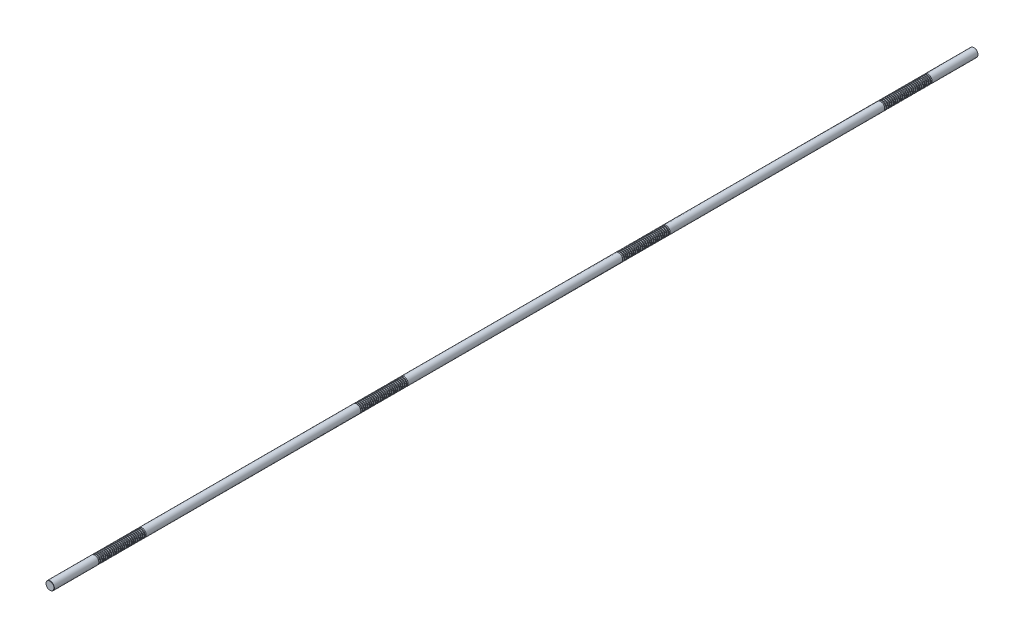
SolidWorks part; units mm, degrees
ref_plane "Front Plane" through (0, 0, 0) normal (0, 0, 1) x (1, 0, 0)
ref_plane "Top Plane" through (0, 0, 0) normal (0, 1, 0) x (1, 0, 0)
ref_plane "Right Plane" through (0, 0, 0) normal (1, 0, 0) x (0, 0, -1)
sketch "Sketch1" plane through (0, 0, 0) normal (0, 0, 1) x (1, 0, 0)
  circle A0 centre (0, 0) radius 9
  dimension "D1" = 18
extrude "Boss-Extrude1" add sketch "Sketch1" along normal mid plane 2000
chamfer "Chamfer1" distance 0.45 angle 45 2 edges at (9, 0, -1000) (9, 0, 1000)
sketch "Sketch2" plane through (0, 0, 0) normal (1, 0, 0) x (0, 0, -1)
  line L0 (900.3014, 9) -> (897.6986, 9)
  line L1 (999.55, 9) -> (-999.55, 9) construction
  line L2 (897.6986, 9) -> (898.3014, 6.75)
  line L3 (898.3014, 6.75) -> (899.6986, 6.75)
  line L4 (899.6986, 6.75) -> (900.3014, 9)
  line L5 (1000, -8.55) -> (1000, 8.55) construction
  point P4 (899, 9)
  point P7 (899, 6.75)
  point P8 (900, 7.875)
  point P9 (898, 7.875)
  dimension "D1" = 2
  dimension "D2" = 100
  dimension "D3" = 2.25
  dimension "D4" = 30
revolve "Cut-Revolve1" cut sketch "Sketch2" angle 360 about axis through (0, 0, 1000) along (0, 0, -1)
pattern_linear "LPattern1" count 26 spacing 4 along (0, 0, 1) of "Cut-Revolve1"
pattern_linear "LPattern2" count 4 spacing 567 along (0, 0, 1) of "Cut-Revolve1", "LPattern1"
